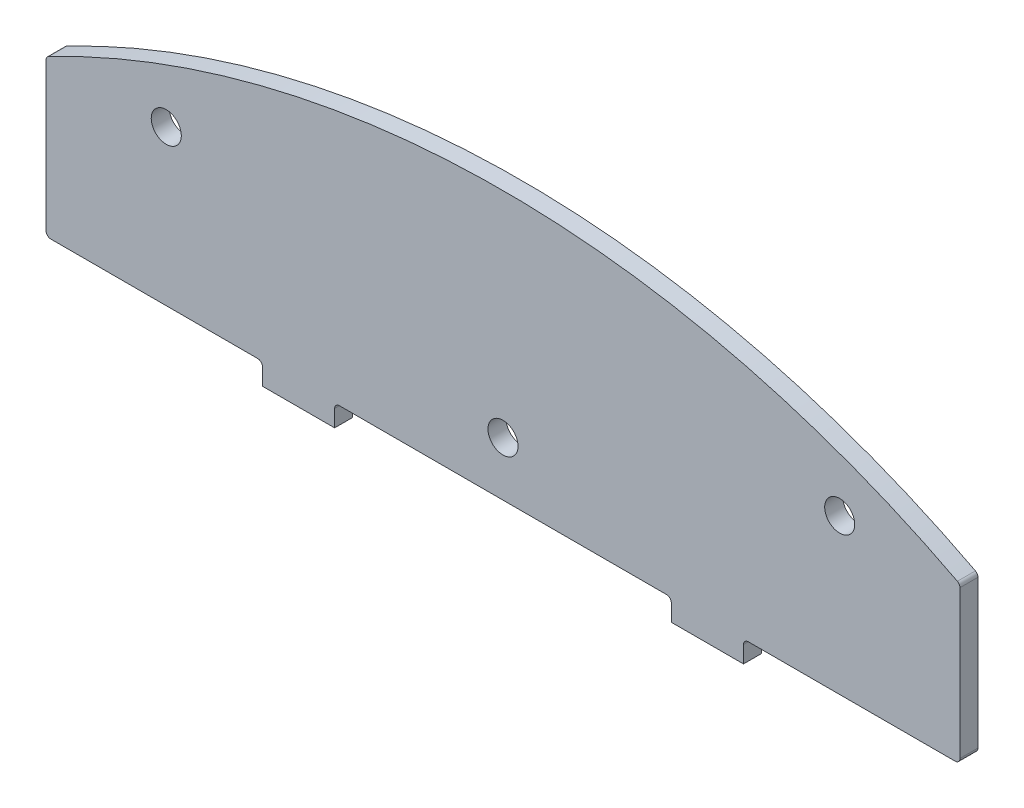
SolidWorks part; units mm, degrees
ref_plane "Front Plane" through (0, 0, 0) normal (0, 0, 1) x (1, 0, 0)
ref_plane "Top Plane" through (0, 0, 0) normal (0, 1, 0) x (1, 0, 0)
ref_plane "Right Plane" through (0, 0, 0) normal (1, 0, 0) x (0, 0, -1)
sketch "Sketch1" plane through (0, 0, 0) normal (0, 0, 1) x (1, 0, 0)
  line L0 (-120.65, 229.9901) -> (-120.65, 188.9125)
  line L1 (-120.65, 188.9125) -> (-63.5, 188.9125)
  line L2 (0, 111.3821) -> (0, 306.9702) construction
  line L3 (-44.45, 188.9125) -> (44.45, 188.9125)
  line L4 (120.65, 229.9901) -> (120.65, 188.9125)
  line L5 (44.45, 188.9125) -> (44.45, 183.2042)
  line L6 (-63.5, 188.9125) -> (-63.5, 183.2042)
  line L7 (-63.5, 183.2042) -> (-44.45, 183.2042)
  line L8 (-44.45, 188.9125) -> (-44.45, 183.2042)
  line L9 (63.5, 183.2042) -> (44.45, 183.2042)
  line L10 (63.5, 188.9125) -> (63.5, 183.2042)
  line L11 (120.65, 188.9125) -> (63.5, 188.9125)
  arc A1 (120.65, 229.9901) -> (-120.65, 229.9901) centre (0, 0) ccw
  point P17 (0, 188.9125)
  point P18 (0, 188.9125)
  dimension "D1" = 241.3
  dimension "D3" = 259.715
  dimension "D2" = 188.9125
  dimension "D4" = 44.45
  dimension "D5" = 19.05
extrude "Extrude1" add sketch "Sketch1" along normal blind 4.7625
hole_wizard "5/16 (0.3125) Diameter Hole1" positions "Sketch3" profile "Sketch2" hole size "5/16" standard "Ansi Inch"
sketch "Sketch3" plane through (0, 0, 0) normal (0, 0, -1) x (-1, 0, 0)
  point P1 (0, 203.2)
  point P4 (-88.8995, 229.7825)
  point P7 (88.9005, 229.7835)
sketch "Sketch2" plane through (0, 203.2, 0) normal (1, 0, 0) x (0, 1, 0)
  line L0 (0, 0) -> (0, 4.7625)
  line L1 (0, 4.7625) -> (3.9687, 4.7625)
  line L2 (3.9687, 4.7625) -> (3.9688, 0)
  line L5 (3.9688, 0) -> (0, 0)
  line L11 (0, -6.35) -> (0, 107.95) construction
  dimension "Thru Hole Dia." = 7.9375
  dimension "Thru Hole Depth" = 4.7625
fillet "Fillet2" [suppressed] radius 1.27
fillet "Fillet1" radius 1.27 4 edges at (-120.65, 188.9125, 2.3813) (-120.65, 229.9901, 2.3813) (120.65, 229.9901, 2.3813) (120.65, 188.9125, 2.3813)
fillet "Fillet3" radius 1.27 4 edges at (63.5, 188.9125, 2.3813) (-44.45, 188.9125, 2.3813) (44.45, 188.9125, 2.3813) (-63.5, 188.9125, 2.3813)
